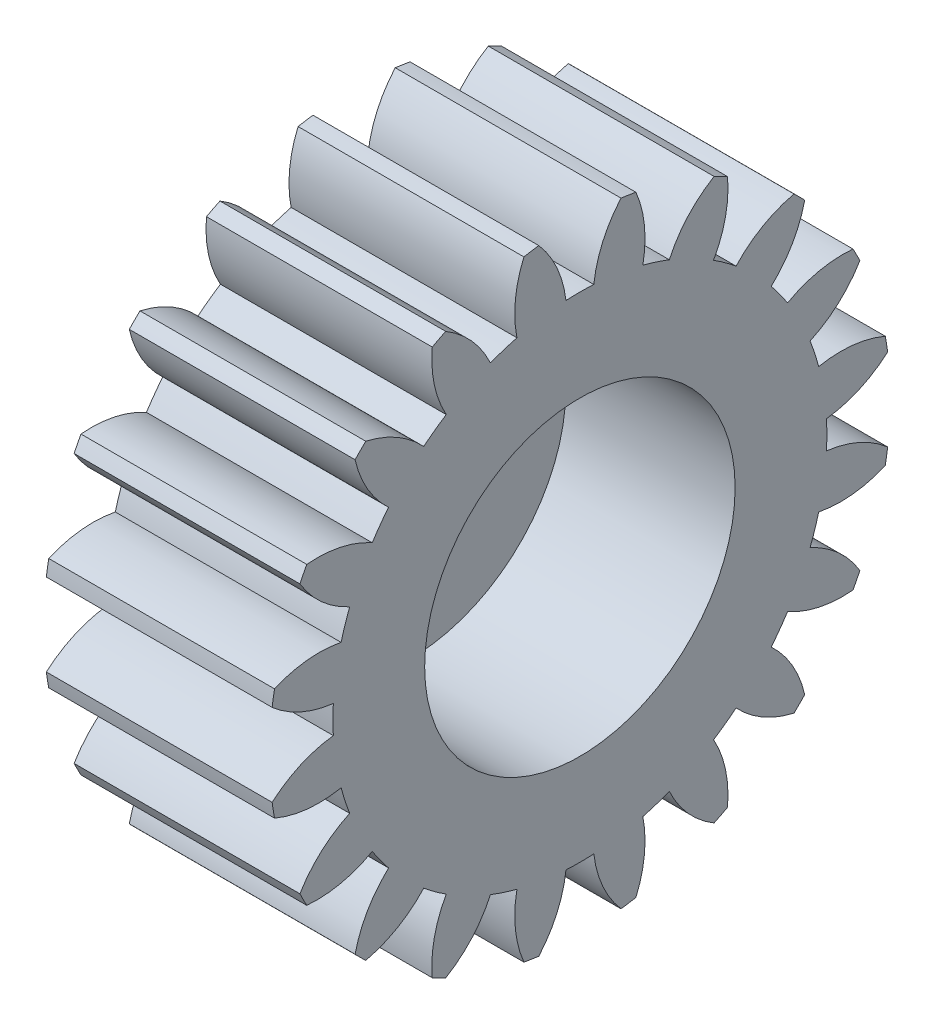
SolidWorks part; units mm, degrees
ref_plane "Front Plane" through (0, 0, 0) normal (0, 0, 1) x (1, 0, 0)
ref_plane "Top Plane" through (0, 0, 0) normal (0, 1, 0) x (1, 0, 0)
ref_plane "Right Plane" through (0, 0, 0) normal (1, 0, 0) x (0, 0, -1)
imported_body "spur gear_am-1-solid1"
sketch "Sketch2" plane through (-21.4997, 0, 0) normal (-1, 0, 0) x (0, 0, 1)
  circle A0 centre (1.5393, 9.5012) radius 11 construction
  circle A1 centre (1.5393, 9.5012) radius 11
extrude "Boss-Extrude2" add sketch "Sketch2" against normal blind 4
sketch "Sketch3" plane through (-21.4997, 0, 0) normal (-1, 0, 0) x (0, 0, 1)
  circle A0 centre (1.5393, 9.5012) radius 2.5
  dimension "D1" = 5
extrude "Cut-Extrude1" cut sketch "Sketch3" against normal blind 10
